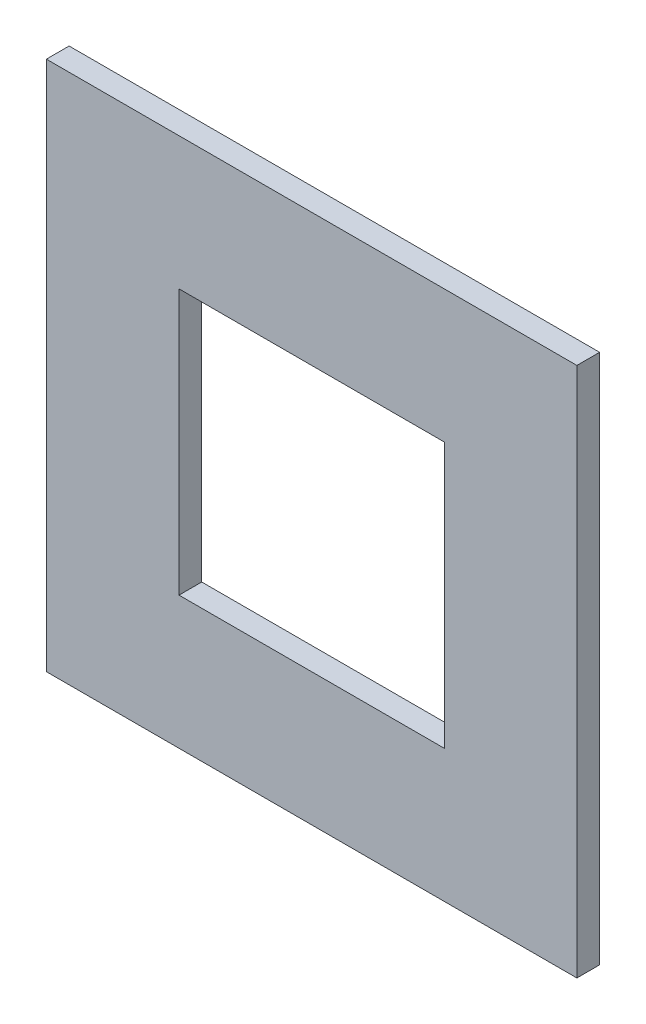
SolidWorks part; units mm, degrees
ref_plane "Plan de face" through (0, 0, 0) normal (0, 0, 1) x (1, 0, 0)
ref_plane "Plan de dessus" through (0, 0, 0) normal (0, 1, 0) x (1, 0, 0)
ref_plane "Plan de droite" through (0, 0, 0) normal (1, 0, 0) x (0, 0, -1)
sketch "Esquisse1" plane through (0, 0, 0) normal (0, 0, 1) x (1, 0, 0)
  line L1 (-35, 35) -> (35, 35)
  line L2 (-35, 35) -> (-35, -35)
  line L3 (-35, -35) -> (35, -35)
  line L4 (35, 35) -> (35, -35)
  line L5 (-35, 35) -> (35, -35) construction
  line L6 (-35, -35) -> (35, 35) construction
  line L11 (-17.5, 17.5) -> (17.5, 17.5)
  line L12 (-17.5, 17.5) -> (-17.5, -17.5)
  line L13 (-17.5, -17.5) -> (17.5, -17.5)
  line L14 (17.5, 17.5) -> (17.5, -17.5)
  line L15 (-17.5, 17.5) -> (17.5, -17.5) construction
  line L16 (-17.5, -17.5) -> (17.5, 17.5) construction
  point P0 (0, 0)
  point P11 (0, 0)
  dimension "D1" = 70
  dimension "D2" = 35
extrude "Boss.-Extru.1" add sketch "Esquisse1" along normal blind 3
